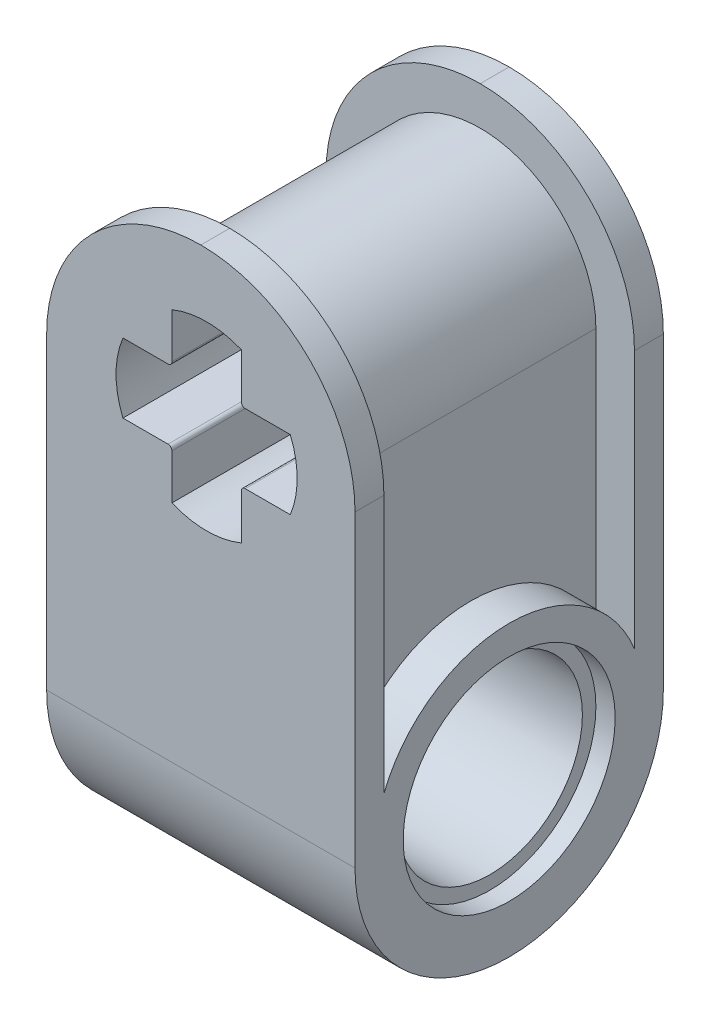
SolidWorks part; units mm, degrees
ref_plane "Alzado" through (0, 0, 0) normal (0, 0, 1) x (1, 0, 0)
ref_plane "Planta" through (0, 0, 0) normal (0, 1, 0) x (1, 0, 0)
ref_plane "Vista lateral" through (0, 0, 0) normal (1, 0, 0) x (0, 0, -1)
sketch "Croquis1" plane through (0, 0, 0) normal (1, 0, 0) x (0, 0, -1)
  line L0 (-4, 0) -> (-4, 12)
  line L1 (4, 0) -> (4, 12)
  line L2 (-4, 12) -> (4, 12)
  arc A0 (-4, 0) -> (4, 0) centre (0, 0) ccw
  circle A1 centre (0, 0) radius 2.4
  dimension "D1" = 8
  dimension "D4" = 4.8
  dimension "D2" = 12
  dimension "D3" = 12
extrude "Extruir1" add sketch "Croquis1" along normal mid plane 8
sketch "Croquis2" plane through (4, 0, 0) normal (1, 0, 0) x (0, 0, -1)
  circle A0 centre (0, 0) radius 2.75
  circle A1 centre (0, 0) radius 2.4 construction
  dimension "D1" = 5.5
extrude "Cortar-Extruir1" cut sketch "Croquis2" against normal blind 0.5
mirror "Simetría1" about plane through (0, 0, 0) normal (1, 0, 0) of "Cortar-Extruir1"
sketch "Croquis4" plane through (0, 0, 4) normal (0, 0, 1) x (1, 0, 0)
  line L0 (-3.0427, 8) -> (0.15, 8) construction
  line L1 (4, 0) -> (-4, 0) construction
  line L2 (-2.0208, 8.9) -> (-0.85, 8.9)
  line L3 (-0.75, 9) -> (-0.75, 10.1708)
  line L4 (0.15, 8) -> (0.15, 11.7838) construction
  line L5 (-0.75, 7) -> (-0.75, 5.8292)
  line L6 (-2.0208, 7.1) -> (-0.85, 7.1)
  line L7 (2.3208, 7.1) -> (1.15, 7.1)
  line L8 (1.05, 7) -> (1.05, 5.8292)
  line L9 (1.05, 9) -> (1.05, 10.1708)
  line L10 (2.3208, 8.9) -> (1.15, 8.9)
  line L11 (-4, 12) -> (-4, 0) construction
  arc A0 (1.05, 10.1708) -> (-0.75, 10.1708) centre (0.15, 8) ccw
  arc A1 (-0.85, 8.9) -> (-0.75, 9) centre (-0.85, 9) ccw
  arc A2 (-2.0208, 8.9) -> (-2.0208, 7.1) centre (0.15, 8) ccw
  arc A3 (-0.85, 7.1) -> (-0.75, 7) centre (-0.85, 7) cw
  arc A4 (1.05, 5.8292) -> (-0.75, 5.8292) centre (0.15, 8) cw
  arc A5 (1.15, 7.1) -> (1.05, 7) centre (1.15, 7) ccw
  arc A6 (2.3208, 8.9) -> (2.3208, 7.1) centre (0.15, 8) cw
  arc A7 (1.15, 8.9) -> (1.05, 9) centre (1.15, 9) cw
  point P1 (0, 0)
  dimension "D2" = 2.35
  dimension "D3" = 0.1
  dimension "D1" = 8
  dimension "D4" = 1.8
  dimension "D5" = 1.8
  dimension "D6" = 3.25
extrude "Cortar-Extruir3" cut sketch "Croquis4" against normal through all
sketch "Croquis5" plane through (0, 0, 0) normal (0, 0, 1) x (1, 0, 0)
  line L1 (-4, 8) -> (4, 8) construction
  line L2 (-4, 8) -> (-3, 8)
  line L3 (3, 8) -> (4, 8)
  line L4 (-4, 8) -> (-4, 12)
  line L5 (-4, 12) -> (4, 12)
  line L6 (4, 12) -> (4, 8)
  arc A2 (3, 8) -> (-3, 8) centre (0, 8) ccw
  dimension "D1" = 3
  dimension "D2" = 4
  dimension "D3" = 1
extrude "Cortar-Extruir6" cut sketch "Croquis5" against normal mid plane 6.5
sketch "Croquis7" plane through (4, 0, 0) normal (1, 0, 0) x (0, 0, -1)
  line L0 (-3.25, 8) -> (-3.25, 1.299)
  line L1 (3.25, 8) -> (3.25, 1.299)
  line L2 (-3.25, 8) -> (3.25, 8)
  arc A0 (3.25, 1.299) -> (-3.25, 1.299) centre (0, 0) ccw
  dimension "D1" = 3.5
extrude "Cortar-Extruir8" cut sketch "Croquis7" against normal up to vertex
sketch "Croquis8" plane through (-4, 0, 0) normal (-1, 0, 0) x (0, 0, 1)
  line L0 (-3.25, 8) -> (-3.25, 1.299)
  line L1 (0, 0) -> (0, 5.307) construction
  line L2 (-3.25, 8) -> (3.25, 8)
  line L4 (3.25, 8) -> (3.25, 1.299)
  arc A0 (-3.25, 1.299) -> (3.25, 1.299) centre (0, 0) cw
  circle A1 centre (0, 0) radius 2.75 construction
  dimension "D1" = 3.5
  dimension "D2" = 6.701
extrude "Cortar-Extruir10" cut sketch "Croquis8" against normal up to vertex
fillet "Fillet1" radius 4 4 edges at (-4, 12, 3.625) (4, 12, 3.625) (4, 12, -3.625) (-4, 12, -3.625)
